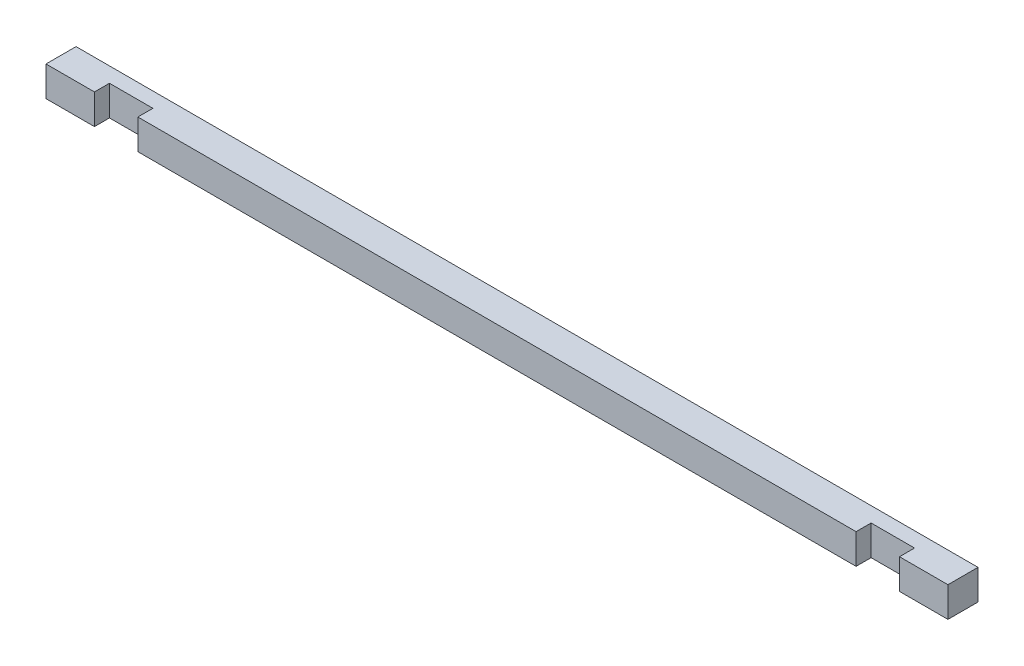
SolidWorks part; units mm, degrees
ref_plane "Plan de face" through (0, 0, 0) normal (0, 0, 1) x (1, 0, 0)
ref_plane "Plan de dessus" through (0, 0, 0) normal (0, 1, 0) x (1, 0, 0)
ref_plane "Plan de droite" through (0, 0, 0) normal (1, 0, 0) x (0, 0, -1)
sketch "Esquisse1" plane through (0, 0, 0) normal (0, 0, 1) x (1, 0, 0)
  line L1 (0, 0) -> (270, 0)
  line L2 (0, 0) -> (0, 9)
  line L3 (0, 9) -> (270, 9)
  line L4 (270, 0) -> (270, 9)
  dimension "D1" = 270
  dimension "D2" = 9
extrude "Extrusion1" add sketch "Esquisse1" along normal blind 9
sketch "Esquisse2" plane through (0, 0, 9) normal (0, 0, 1) x (1, 0, 0)
  line L0 (0, 0) -> (270, 0) construction
  line L1 (14.5, 0) -> (27.5, 0)
  line L2 (14.5, 0) -> (14.5, 9)
  line L3 (14.5, 9) -> (27.5, 9)
  line L4 (27.5, 0) -> (27.5, 9)
  line L5 (270, 9) -> (0, 9) construction
  line L7 (242.5, 0) -> (255.5, 0)
  line L8 (242.5, 0) -> (242.5, 9)
  line L9 (242.5, 9) -> (255.5, 9)
  line L10 (255.5, 0) -> (255.5, 9)
  dimension "D1" = 13
  dimension "D2" = 13
  dimension "D3" = 14.5
  dimension "D4" = 14.5
extrude "Enlèv. mat.-Extru.1" cut sketch "Esquisse2" against normal blind 4.5
